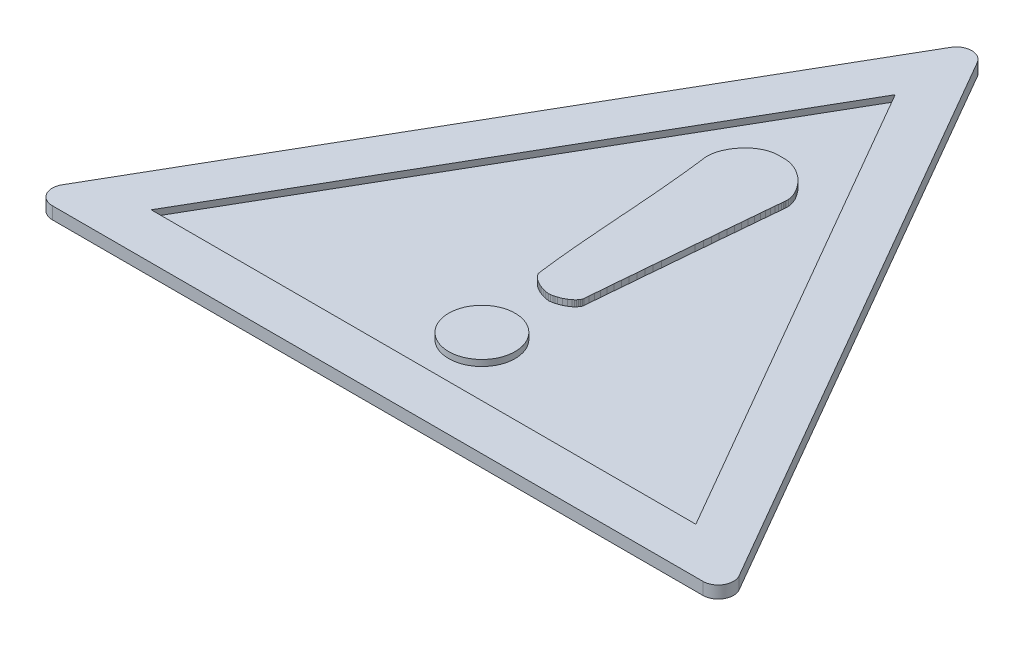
SolidWorks part; units mm, degrees
ref_plane "Vorne" through (0, 0, 0) normal (0, 0, 1) x (1, 0, 0)
ref_plane "Oben" through (0, 0, 0) normal (0, 1, 0) x (1, 0, 0)
ref_plane "Rechts" through (0, 0, 0) normal (1, 0, 0) x (0, 0, -1)
sketch "Skizze1" plane through (0, 0, 0) normal (0, 1, 0) x (1, 0, 0)
  line L0 (-15.8835, 2.5) -> (18.1545, 2.5) construction
  line L1 (0, -5.5346) -> (0, 10.5158) construction
  line L3 (-12.5, 15) -> (12.5, 15)
  line L4 (-12.5, 15) -> (-12.5, -10)
  line L5 (-12.5, -10) -> (12.5, -10)
  line L6 (12.5, 15) -> (12.5, -10)
  dimension "D1" = 25
  dimension "D2" = 25
  dimension "D3" = 2.5
extrude "Linear austragen1" add sketch "Skizze1" along normal blind 0.2
sketch "Skizze2" plane through (0, 0.2, 0) normal (0, 1, 0) x (-1, 0, 0)
  line L0 (11.5, 6.6395) -> (-5.75, -3.3198) construction
  line L1 (-11.5, 6.6395) -> (5.75, -3.3198) construction
  line L2 (0, -13.2791) -> (0, 6.6395) construction
  line L3 (11.5, 6.6395) -> (0, -13.2791)
  line L4 (0, -13.2791) -> (-11.5, 6.6395)
  line L5 (-11.5, 6.6395) -> (11.5, 6.6395)
  point P0 (0, 0)
  dimension "D1" = 23
extrude "Linear-Austragen-Dünn1" add sketch "Skizze2" along normal blind 0.2 thin
fillet "Verrundung1" radius 0.5 3 edges at (0, 0.3, -13.2791) (11.5, 0.3, 6.6395) (-11.5, 0.3, 6.6395)
sketch "Skizze3" plane through (-8.812, 0.2, 7.6348) normal (0, 1, 0) x (1, 0, 0)
  line L0 (8.6991, 14.2909) -> (8.5695, 14.2909)
  line L3 (8.5695, 14.2909) -> (8.4435, 14.2765)
  line L4 (8.4435, 14.2765) -> (8.3211, 14.2441)
  line L5 (8.3211, 14.2441) -> (8.2059, 14.1973)
  line L6 (8.2059, 14.1973) -> (8.0943, 14.1361)
  line L7 (8.0943, 14.1361) -> (7.9899, 14.0641)
  line L8 (7.9899, 14.0641) -> (7.8927, 13.9813)
  line L9 (7.8927, 13.9813) -> (7.8063, 13.8913)
  line L10 (7.8063, 13.8913) -> (7.7271, 13.7905)
  line L11 (7.7271, 13.7905) -> (7.6551, 13.6861)
  line L12 (7.6551, 13.6861) -> (7.5975, 13.5781)
  line L13 (7.5975, 13.5781) -> (7.5471, 13.4665)
  line L14 (7.5471, 13.4665) -> (7.5111, 13.3513)
  line L15 (7.5111, 13.3513) -> (7.4895, 13.2361)
  line L16 (7.4895, 13.2361) -> (7.4787, 13.1245)
  line L17 (7.4787, 13.1245) -> (7.4823, 13.0129)
  line L18 (7.4823, 13.0129) -> (7.5075, 12.8257)
  line L19 (7.5075, 12.8257) -> (7.5291, 12.6385)
  line L20 (7.5291, 12.6385) -> (7.5507, 12.4549)
  line L21 (7.5507, 12.4549) -> (7.5723, 12.2677)
  line L22 (7.5723, 12.2677) -> (7.5903, 12.0805)
  line L23 (7.5903, 12.0805) -> (7.6083, 11.8933)
  line L24 (7.6083, 11.8933) -> (7.6263, 11.7097)
  line L25 (7.6263, 11.7097) -> (7.6443, 11.5225)
  line L26 (7.6443, 11.5225) -> (7.6587, 11.3353)
  line L27 (7.6587, 11.3353) -> (7.6767, 11.1481)
  line L28 (7.6767, 11.1481) -> (7.6911, 10.9609)
  line L29 (7.6911, 10.9609) -> (7.7055, 10.7737)
  line L30 (7.7055, 10.7737) -> (7.7199, 10.5901)
  line L31 (7.7199, 10.5901) -> (7.7343, 10.4029)
  line L32 (7.7343, 10.4029) -> (7.7487, 10.2157)
  line L33 (7.7487, 10.2157) -> (7.7595, 10.0285)
  line L34 (7.7595, 10.0285) -> (7.7739, 9.8413)
  line L35 (7.7739, 9.8413) -> (7.7883, 9.6541)
  line L36 (7.7883, 9.6541) -> (7.8027, 9.4669)
  line L37 (7.8027, 9.4669) -> (7.8171, 9.2833)
  line L38 (7.8171, 9.2833) -> (7.8315, 9.0961)
  line L39 (7.8315, 9.0961) -> (7.8459, 8.9089)
  line L40 (7.8459, 8.9089) -> (7.8603, 8.7217)
  line L41 (7.8603, 8.7217) -> (7.8783, 8.5345)
  line L42 (7.8783, 8.5345) -> (7.8927, 8.3473)
  line L43 (7.8927, 8.3473) -> (7.9107, 8.1637)
  line L44 (7.9107, 8.1637) -> (7.9287, 7.9765)
  line L45 (7.9287, 7.9765) -> (7.9467, 7.7893)
  line L46 (7.9467, 7.7893) -> (7.9683, 7.6021)
  line L47 (7.9683, 7.6021) -> (7.9899, 7.4185)
  line L48 (7.9899, 7.4185) -> (8.0115, 7.2313)
  line L49 (8.0115, 7.2313) -> (8.0367, 7.0441)
  line L50 (8.0367, 7.0441) -> (8.0475, 7.0081)
  line L51 (8.0475, 7.0081) -> (8.0691, 6.9721)
  line L52 (8.0691, 6.9721) -> (8.0943, 6.9325)
  line L53 (8.0943, 6.9325) -> (8.1303, 6.8965)
  line L54 (8.1303, 6.8965) -> (8.1699, 6.8605)
  line L55 (8.1699, 6.8605) -> (8.2131, 6.8281)
  line L56 (8.2131, 6.8281) -> (8.2599, 6.7957)
  line L57 (8.2599, 6.7957) -> (8.3139, 6.7633)
  line L58 (8.3139, 6.7633) -> (8.3679, 6.7345)
  line L59 (8.3679, 6.7345) -> (8.4255, 6.7093)
  line L60 (8.4255, 6.7093) -> (8.4867, 6.6841)
  line L61 (8.4867, 6.6841) -> (8.5479, 6.6625)
  line L62 (8.5479, 6.6625) -> (8.6091, 6.6445)
  line L63 (8.6091, 6.6445) -> (8.6667, 6.6301)
  line L64 (8.6667, 6.6301) -> (8.7279, 6.6229)
  line L65 (8.7279, 6.6229) -> (8.7855, 6.6157)
  line L66 (8.7855, 6.6157) -> (8.8431, 6.6229)
  line L67 (8.8431, 6.6229) -> (8.9007, 6.6337)
  line L68 (8.9007, 6.6337) -> (8.9619, 6.6481)
  line L69 (8.9619, 6.6481) -> (9.0195, 6.6661)
  line L70 (9.0195, 6.6661) -> (9.0771, 6.6877)
  line L71 (9.0771, 6.6877) -> (9.1347, 6.7093)
  line L72 (9.1347, 6.7093) -> (9.1887, 6.7381)
  line L73 (9.1887, 6.7381) -> (9.2427, 6.7669)
  line L74 (9.2427, 6.7669) -> (9.2895, 6.7993)
  line L75 (9.2895, 6.7993) -> (9.3363, 6.8317)
  line L76 (9.3363, 6.8317) -> (9.3759, 6.8677)
  line L77 (9.3759, 6.8677) -> (9.4119, 6.9037)
  line L78 (9.4119, 6.9037) -> (9.4407, 6.9397)
  line L79 (9.4407, 6.9397) -> (9.4659, 6.9757)
  line L80 (9.4659, 6.9757) -> (9.4839, 7.0153)
  line L81 (9.4839, 7.0153) -> (9.4947, 7.0513)
  line L82 (9.4947, 7.0513) -> (9.5055, 7.2061)
  line L83 (9.5055, 7.2061) -> (9.5199, 7.3789)
  line L84 (9.5199, 7.3789) -> (9.5379, 7.5625)
  line L85 (9.5379, 7.5625) -> (9.5523, 7.7605)
  line L86 (9.5523, 7.7605) -> (9.5703, 7.9693)
  line L87 (9.5703, 7.9693) -> (9.5883, 8.1889)
  line L88 (9.5883, 8.1889) -> (9.6099, 8.4157)
  line L89 (9.6099, 8.4157) -> (9.6315, 8.6533)
  line L90 (9.6315, 8.6533) -> (9.6495, 8.8945)
  line L91 (9.6495, 8.8945) -> (9.6711, 9.1393)
  line L92 (9.6711, 9.1393) -> (9.6963, 9.3913)
  line L93 (9.6963, 9.3913) -> (9.7179, 9.6433)
  line L94 (9.7179, 9.6433) -> (9.7395, 9.8953)
  line L95 (9.7395, 9.8953) -> (9.7611, 10.1473)
  line L96 (9.7611, 10.1473) -> (9.7827, 10.3993)
  line L97 (9.7827, 10.3993) -> (9.8079, 10.6477)
  line L98 (9.8079, 10.6477) -> (9.8295, 10.8889)
  line L99 (9.8295, 10.8889) -> (9.8475, 11.1265)
  line L100 (9.8475, 11.1265) -> (9.8691, 11.3569)
  line L101 (9.8691, 11.3569) -> (9.8907, 11.5801)
  line L102 (9.8907, 11.5801) -> (9.9087, 11.7925)
  line L103 (9.9087, 11.7925) -> (9.9267, 11.9941)
  line L104 (9.9267, 11.9941) -> (9.9447, 12.1849)
  line L105 (9.9447, 12.1849) -> (9.9591, 12.3613)
  line L106 (9.9591, 12.3613) -> (9.9735, 12.5197)
  line L107 (9.9735, 12.5197) -> (9.9879, 12.6673)
  line L108 (9.9879, 12.6673) -> (9.9987, 12.7933)
  line L109 (9.9987, 12.7933) -> (10.0095, 12.9013)
  line L110 (10.0095, 12.9013) -> (10.0167, 12.9913)
  line L111 (10.0167, 12.9913) -> (10.0239, 13.0561)
  line L112 (10.0239, 13.0561) -> (10.0275, 13.0993)
  line L113 (10.0275, 13.0993) -> (10.0311, 13.1209)
  line L114 (10.0311, 13.1209) -> (10.0311, 13.2073)
  line L115 (10.0311, 13.2073) -> (10.0167, 13.2973)
  line L116 (10.0167, 13.2973) -> (9.9879, 13.3945)
  line L117 (9.9879, 13.3945) -> (9.9447, 13.4989)
  line L118 (9.9447, 13.4989) -> (9.8871, 13.5997)
  line L119 (9.8871, 13.5997) -> (9.8187, 13.7005)
  line L120 (9.8187, 13.7005) -> (9.7395, 13.8013)
  line L121 (9.7395, 13.8013) -> (9.6495, 13.8985)
  line L122 (9.6495, 13.8985) -> (9.5523, 13.9885)
  line L123 (9.5523, 13.9885) -> (9.4443, 14.0677)
  line L124 (9.4443, 14.0677) -> (9.3327, 14.1433)
  line L125 (9.3327, 14.1433) -> (9.2139, 14.2009)
  line L126 (9.2139, 14.2009) -> (9.0879, 14.2477)
  line L127 (9.0879, 14.2477) -> (8.9619, 14.2801)
  line L128 (8.9619, 14.2801) -> (8.8323, 14.2945)
  line L129 (8.8323, 14.2945) -> (8.6991, 14.2909)
  line L194 (8.7855, 6.6157) -> (8.7855, 4.4305) construction
  circle A0 centre (8.7855, 4.4305) radius 1.0862
extrude "Linear austragen2" add sketch "Skizze3" along normal blind 0.2
sketch "Skizze4" plane through (0, 0.4, 0) normal (0, 1, 0) x (-1, 0, 0)
  line L3 (-11.067, 5.8895) -> (-0.433, -12.5291)
  line L4 (0.433, -12.5291) -> (11.067, 5.8895)
  line L5 (10.634, 6.6395) -> (-10.634, 6.6395)
  line L6 (-11.067, 5.8895) -> (-0.433, -12.5291)
  line L7 (0.433, -12.5291) -> (11.067, 5.8895)
  line L8 (10.634, 6.6395) -> (-10.634, 6.6395)
  arc A3 (-0.433, -12.5291) -> (0.433, -12.5291) centre (0, -12.2791) ccw
  arc A4 (11.067, 5.8895) -> (10.634, 6.6395) centre (10.634, 6.1395) ccw
  arc A5 (-10.634, 6.6395) -> (-11.067, 5.8895) centre (-10.634, 6.1395) ccw
  arc A6 (-0.433, -12.5291) -> (0.433, -12.5291) centre (0, -12.2791) ccw
  arc A7 (11.067, 5.8895) -> (10.634, 6.6395) centre (10.634, 6.1395) ccw
  arc A8 (-10.634, 6.6395) -> (-11.067, 5.8895) centre (-10.634, 6.1395) ccw
  dimension "D1" = 0
extrude "Schnitt-Linear austragen1" cut sketch "Skizze4" against normal up to next (0.4 mm away) flip side to cut
